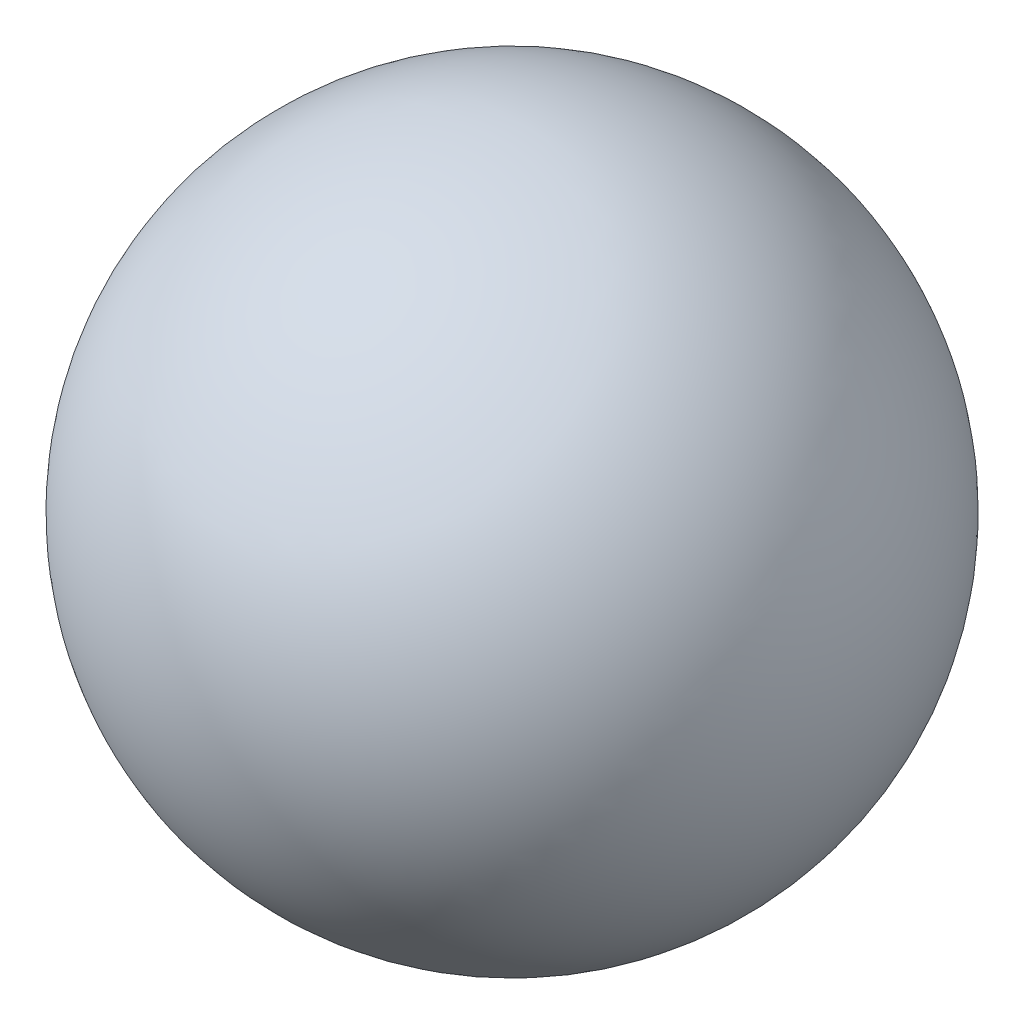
SolidWorks part; units mm, degrees
ref_plane "Front Plane" through (0, 0, 0) normal (0, 0, 1) x (1, 0, 0)
ref_plane "Top Plane" through (0, 0, 0) normal (0, 1, 0) x (1, 0, 0)
ref_plane "Right Plane" through (0, 0, 0) normal (1, 0, 0) x (0, 0, -1)
sketch "Sketch1" plane through (0, 0, 0) normal (0, 1, 0) x (1, 0, 0)
  line L0 (0, 2) -> (0, -2)
  line L1 (0, 2) -> (0, -2) construction
  arc A0 (0, -2) -> (0, 2) centre (0, 0) ccw
revolve "Revolve1" add sketch "Sketch1" angle 360 about L1
